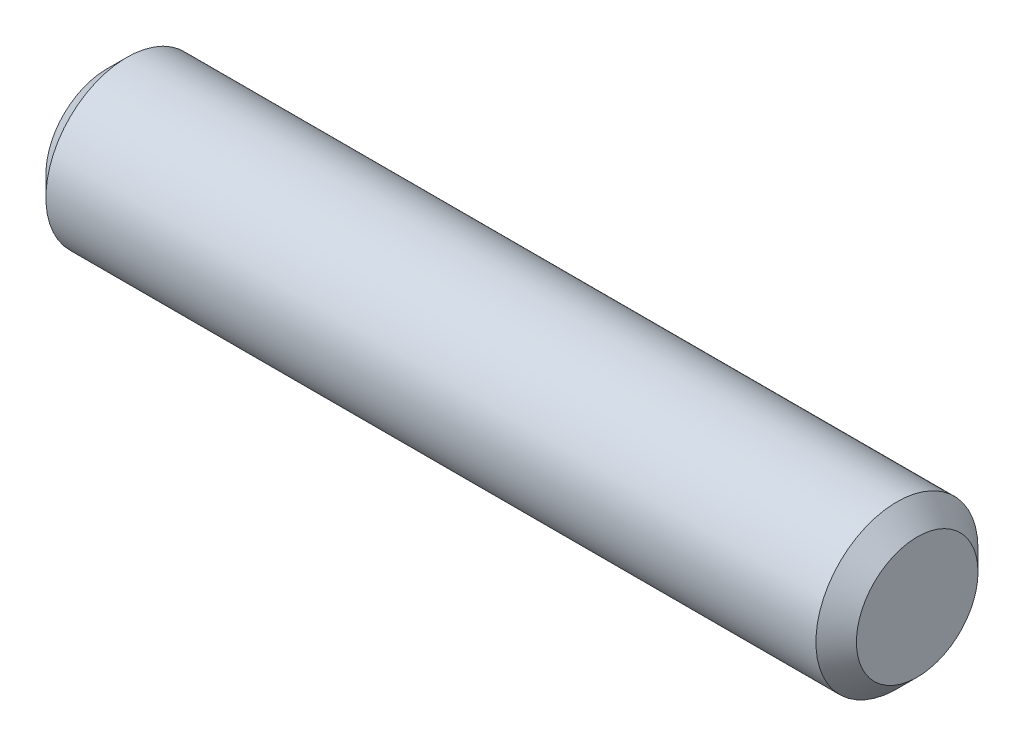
SolidWorks part; units mm, degrees
ref_plane "Front Plane" through (0, 0, 0) normal (0, 0, 1) x (1, 0, 0)
ref_plane "Top Plane" through (0, 0, 0) normal (0, 1, 0) x (1, 0, 0)
ref_plane "Right Plane" through (0, 0, 0) normal (1, 0, 0) x (0, 0, -1)
sketch "Sketch1" plane through (0, 0, 0) normal (1, 0, 0) x (0, 0, -1)
  circle A0 centre (0, 0) radius 2
  dimension "D1" = 4
extrude "Extrude1" add sketch "Sketch1" along normal blind 20
chamfer "Chamfer1" distance 0.5 angle 45 2 edges at (0, 0, -2) (20, 0, -2)
